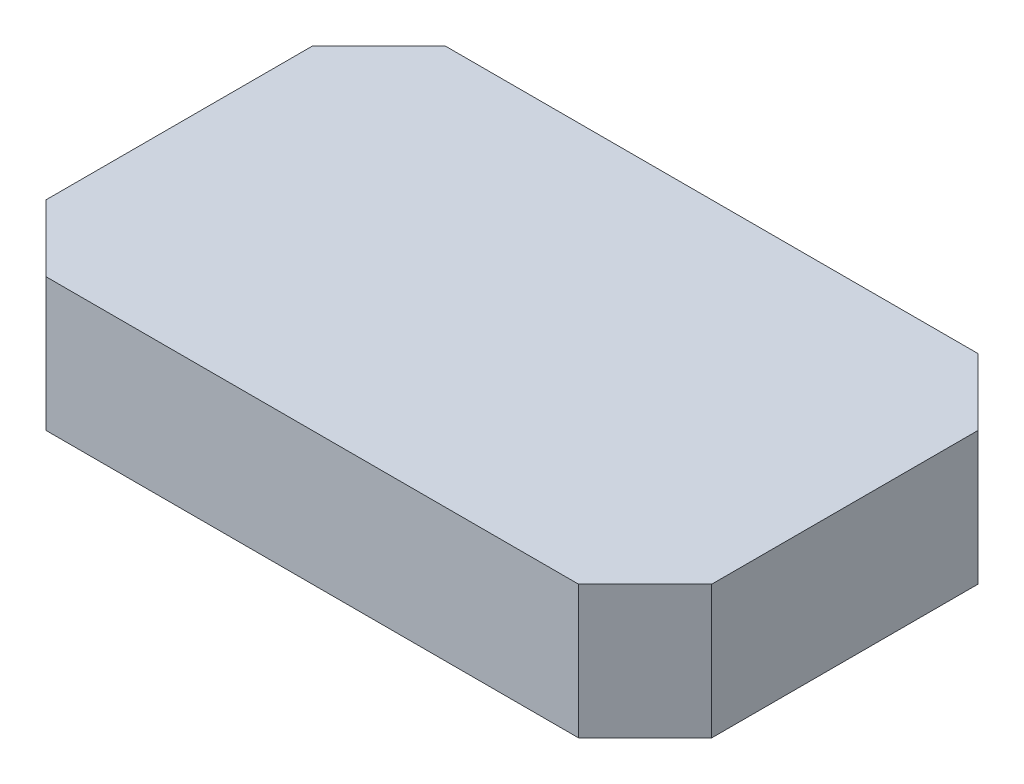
SolidWorks part; units mm, degrees
ref_plane "正面" through (0, 0, 0) normal (0, 0, 1) x (1, 0, 0)
ref_plane "平面" through (0, 0, 0) normal (0, 1, 0) x (1, 0, 0)
ref_plane "右側面" through (0, 0, 0) normal (1, 0, 0) x (0, 0, -1)
sketch "ｽｹｯﾁ1" plane through (0, 0, 0) normal (0, 1, 0) x (1, 0, 0)
  line L1 (-25, -15) -> (25, -15)
  line L2 (-25, -15) -> (-25, 15)
  line L3 (-25, 15) -> (25, 15)
  line L4 (25, -15) -> (25, 15)
  line L5 (-25, -15) -> (25, 15) construction
  line L6 (-25, 15) -> (25, -15) construction
  point P0 (0, 0)
  dimension "D1" = 50
  dimension "D2" = 30
extrude "ﾎﾞｽ - 押し出し1" add sketch "ｽｹｯﾁ1" along normal blind 10
chamfer "面取り2" distance 5 angle 45 4 edges at (25, 5, 15) (25, 5, -15) (-25, 5, -15) (-25, 5, 15)
